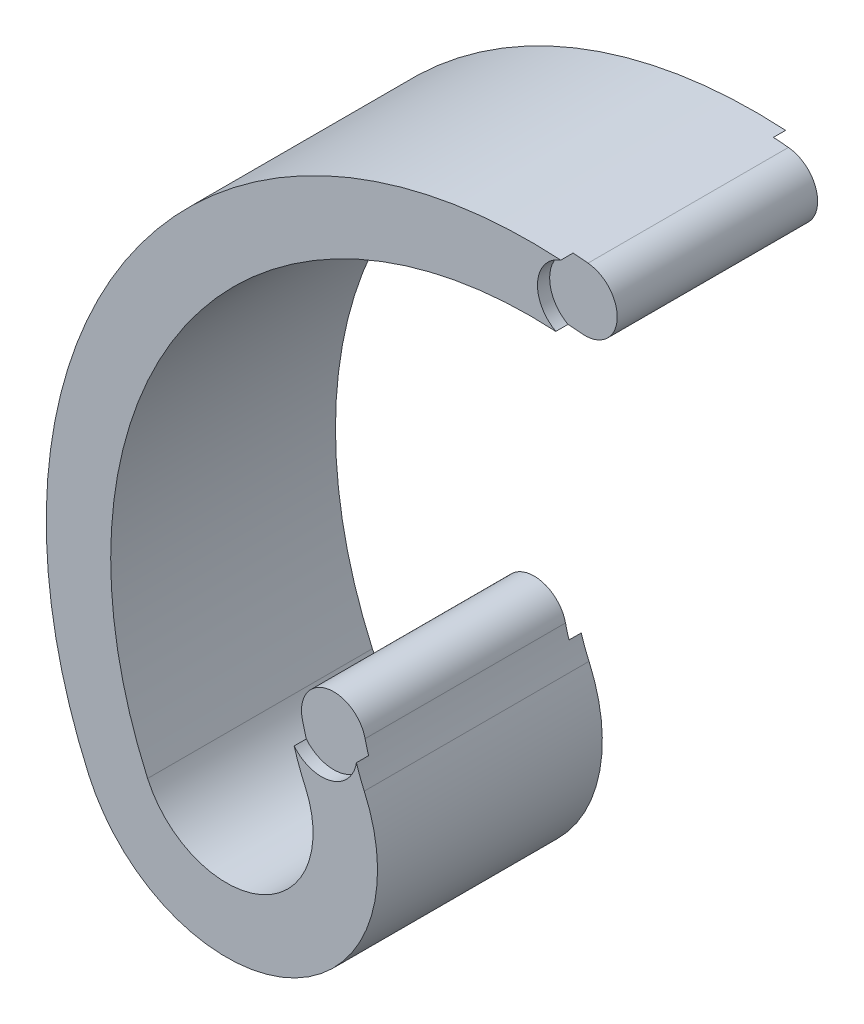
SolidWorks part; units mm, degrees
ref_plane "Ebene vorne" through (0, 0, 0) normal (0, 0, 1) x (1, 0, 0)
ref_plane "Ebene oben" through (0, 0, 0) normal (0, 1, 0) x (1, 0, 0)
ref_plane "Ebene rechts" through (0, 0, 0) normal (1, 0, 0) x (0, 0, -1)
sketch "Skizze1" plane through (0, 0, 0) normal (0, 0, 1) x (1, 0, 0)
  arc A0 (-266, -61.5) -> (-249.0242, -111.9159) centre (0, 0) ccw construction
  arc A1 (-524.7397, -235.8274) -> (-249.0242, -111.9159) centre (-386.882, -173.8716) ccw construction
  arc A2 (53.7731, 572.7781) -> (-524.7397, -235.8274) centre (0, 0) ccw construction
  arc A3 (-266, -61.5) -> (-249.0242, -111.9159) centre (0, 0) ccw
  arc A4 (-524.7397, -235.8274) -> (-249.0242, -111.9159) centre (-386.882, -173.8716) ccw
  arc A5 (53.7731, 572.7781) -> (-524.7397, -235.8274) centre (0, 0) ccw
extrude "Linear-Austragen-Dünn1" add sketch "Skizze1" along normal mid plane 286 thin
sketch "Skizze2" plane through (0, 0, 143) normal (0, 0, 1) x (1, 0, 0)
  line L0 (57.6054, 613.5986) -> (49.9408, 531.9576) construction
  line L1 (-305.9462, -70.7357) -> (-226.0538, -52.2643) construction
  circle A0 centre (53.7731, 572.7781) radius 41
  circle A1 centre (-266, -61.5) radius 41
extrude "Linear austragen1" add sketch "Skizze2" against normal up to surface (286 mm away)
sketch "Skizze3" plane through (0, 0, 143) normal (0, 0, 1) x (1, 0, 0)
  circle A0 centre (-266, -61.5) radius 45
  circle A1 centre (53.7731, 572.7781) radius 45
  dimension "D1" = 90
extrude "Schnitt-Linear austragen1" cut sketch "Skizze3" against normal blind 15.5
mirror "Spiegeln1" about plane through (0, 0, 0) normal (0, 0, 1) of "Schnitt-Linear austragen1"
